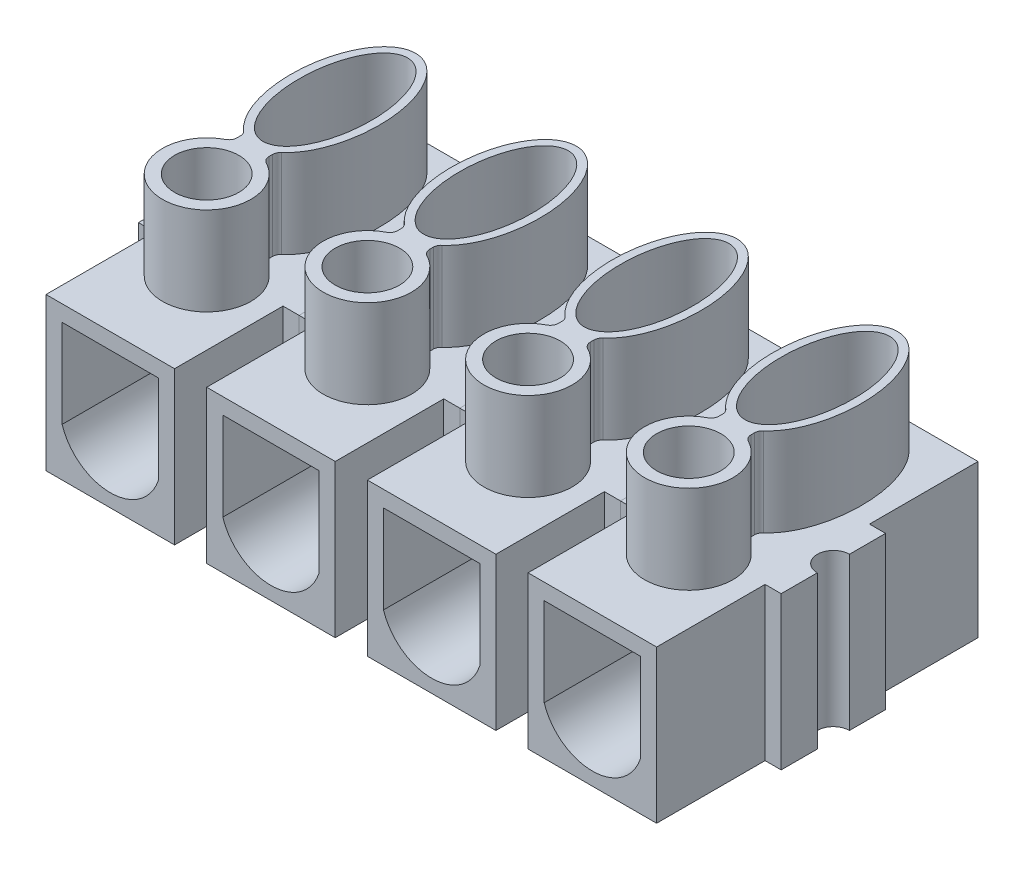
SolidWorks part; units mm, degrees
ref_plane "Plan1" through (0, 0, 0) normal (0, 0, 1) x (1, 0, 0)
ref_plane "Plan2" through (0, 0, 0) normal (0, 1, 0) x (1, 0, 0)
ref_plane "Plan3" through (0, 0, 0) normal (1, 0, 0) x (0, 0, -1)
sketch "Esquisse1" plane through (0, 0, 0) normal (0, 0, 1) x (1, 0, 0)
  line L0 (-2.9974, -1) -> (3, -1)
  line L1 (-4, 0) -> (4, 0)
  line L2 (-4, 0) -> (-4, -9.5)
  line L3 (-4, -9.5) -> (4, -9.5)
  line L4 (4, 0) -> (4, -9.5)
  line L5 (3, -1) -> (3, -6.5)
  line L6 (-2.9974, -1) -> (-2.9974, -6.5)
  arc A0 (-2.9974, -6.5) -> (3, -6.5) centre (0.0013, -5.5355) ccw
  dimension "D8" = 3.15
  dimension "D1" = 8
  dimension "D2" = 9.5
  dimension "D3" = 1
  dimension "D4" = 1
  dimension "D5" = 1.0026
  dimension "D6" = 5.5
  dimension "D7" = 5.5
extrude "Extrusion1" add sketch "Esquisse1" along normal mid plane 20
sketch "Esquisse2" plane through (4, 0, 0) normal (1, 0, 0) x (0, 0, -1)
  line L0 (-10, 0) -> (10, 0) construction
  line L1 (-3.25, 0) -> (3.25, 0)
  line L2 (-3.25, 0) -> (-3.25, -9.5)
  line L3 (-3.25, -9.5) -> (3.25, -9.5)
  line L4 (3.25, 0) -> (3.25, -9.5)
  line L5 (-10, -9.5) -> (10, -9.5) construction
  dimension "D1" = 6.5
extrude "Extrusion2" add sketch "Esquisse2" along normal blind 1
mirror "Symétrie1" about plane through (0, 0, 0) normal (1, 0, 0) of "Extrusion2"
sketch "Esquisse3" plane through (0, 0, 0) normal (0, 1, 0) x (-1, 0, 0)
  line L0 (-5, -3.25) -> (-5, 3.25) construction
  line L1 (-5, 1) -> (-5, -1)
  line L2 (0, -5.2114) -> (0, 4.8181) construction
  line L3 (5, 1) -> (5, -1)
  arc A0 (-5, -1) -> (-5, 1) centre (-5, 0) ccw
  arc A1 (5, -1) -> (5, 1) centre (5, 0) cw
  dimension "D1" = 1
extrude "Enlèv. mat.-Extru.1" cut sketch "Esquisse3" against normal through all
sketch "Esquisse4" plane through (0, 0, 0) normal (0, 1, 0) x (-1, 0, 0)
  circle A0 centre (0, 4) radius 2
  circle A1 centre (0, -4) radius 2
  dimension "D1" = 4
  dimension "D2" = 4
  dimension "D3" = 4
  dimension "D4" = 4
extrude "Enlèv. mat.-Extru.2" cut sketch "Esquisse4" against normal blind 3
sketch "Esquisse5" plane through (0, 0, 0) normal (0, 1, 0) x (-1, 0, 0)
  circle A0 centre (0, 4) radius 2
  circle A1 centre (0, 4) radius 2 construction
  circle A2 centre (0, 4) radius 2.75
  dimension "D1" = 5.5
extrude "Extrusion3" add sketch "Esquisse5" along normal blind 5.5
sketch "Esquisse6" plane through (0, 0, 0) normal (0, 1, 0) x (-1, 0, 0)
  ellipse E0 centre (0, -4) end of major axis (0, -9) minor radius 2.75
  ellipse E1 centre (0, -4) end of major axis (0, -8.5) minor radius 2.25
  dimension "D3" = 4.5
  dimension "D1" = 5.5
  dimension "D2" = 10
  dimension "D4" = 9
extrude "Extrusion4" add sketch "Esquisse6" along normal blind 5.5
sketch "Esquisse7" plane through (0, 0, 0) normal (0, 0, 1) x (1, 0, 0)
  line L0 (2.75, 5.5) -> (-2.75, 5.5) construction
  line L1 (-1, 5.5) -> (1, 5.5)
  line L2 (-1, 5.5) -> (-1, 0)
  line L3 (-1, 0) -> (1, 0)
  line L4 (1, 5.5) -> (1, 0)
  line L5 (4, 0) -> (-4, 0) construction
  dimension "D1" = 2
extrude "Extrusion5" add sketch "Esquisse7" along normal blind 1 from offset 0.5
fillet "Congé1" radius 0.5 4 edges at (-1, 2.75, 1.4383) (-1, 2.75, 0.6577) (1, 2.75, 0.6577) (1, 2.75, 1.4383)
pattern_linear "Répétition linéaire3" count 4 spacing 10 along (1, 0, 0)
